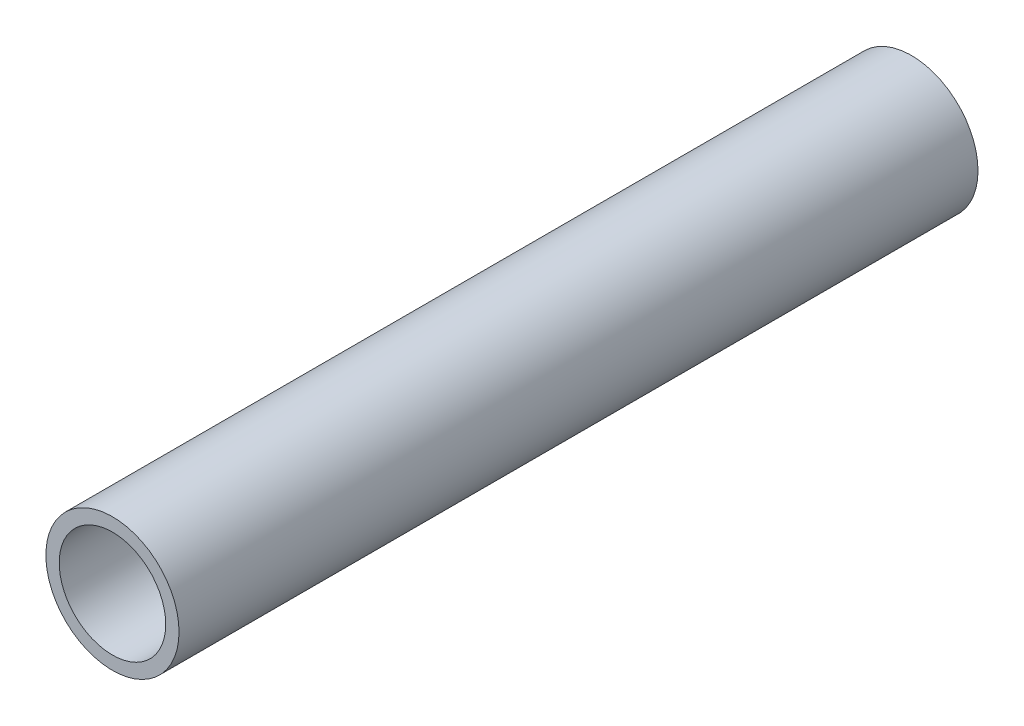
SolidWorks part; units mm, degrees
ref_plane "Piano frontale" through (0, 0, 0) normal (0, 0, 1) x (1, 0, 0)
ref_plane "Piano superiore" through (0, 0, 0) normal (0, 1, 0) x (1, 0, 0)
ref_plane "Piano destro" through (0, 0, 0) normal (1, 0, 0) x (0, 0, -1)
sketch "Schizzo1" plane through (0, 0, 0) normal (0, 0, 1) x (1, 0, 0)
  circle A0 centre (0, 0) radius 5
  dimension "D1" = 10
extrude "Estrusione-Sottile1" add sketch "Schizzo1" along normal blind 60 thin contours A0
